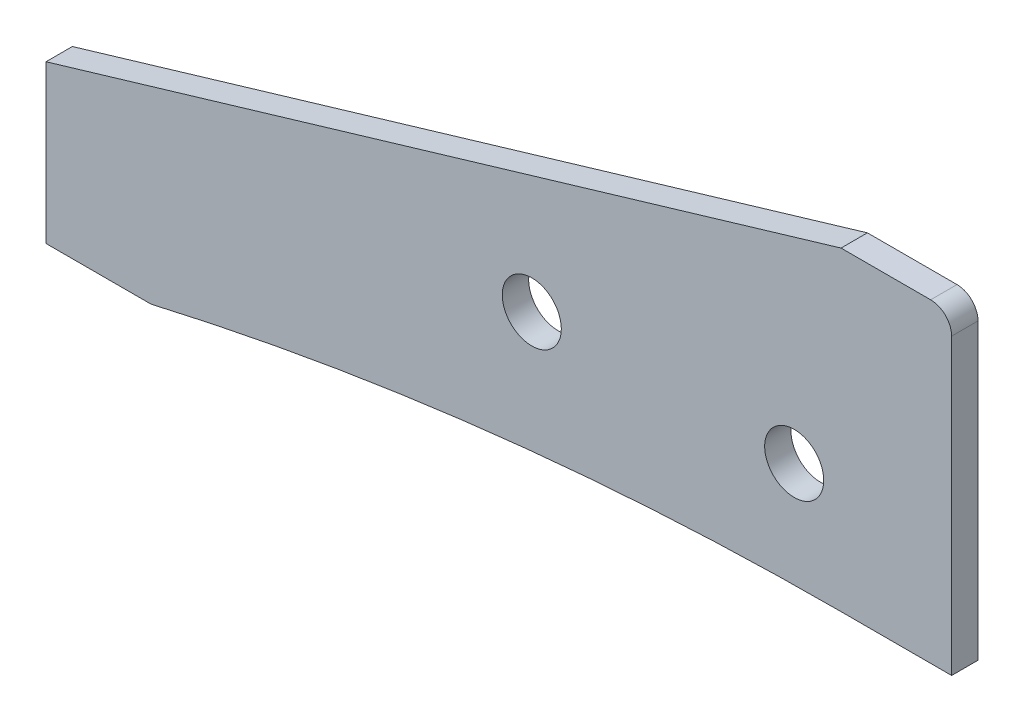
SolidWorks part; units mm, degrees
ref_plane "Front Plane" through (0, 0, 0) normal (0, 0, 1) x (1, 0, 0)
ref_plane "Top Plane" through (0, 0, 0) normal (0, 1, 0) x (1, 0, 0)
ref_plane "Right Plane" through (0, 0, 0) normal (1, 0, 0) x (0, 0, -1)
sketch "Sketch1" plane through (0, 0, 0) normal (0, 0, 1) x (1, 0, 0)
  line L0 (-2.54, 0) -> (-13.3821, 0)
  line L1 (-13.3821, 0) -> (-109.5805, -28.575)
  line L2 (-109.5805, -28.575) -> (-109.5805, -47.625)
  line L3 (-109.5805, -47.625) -> (-96.8805, -47.625)
  line L4 (0, -2.54) -> (0, -38.1)
  line L5 (0, -38.1) -> (-13.3821, -38.1)
  line L9 (-123.825, -47.625) -> (307.975, -47.625) construction
  arc A0 (-96.8805, -47.625) -> (-13.3821, -38.1) centre (-13.3821, -408.846) cw
  arc A1 (-2.54, 0) -> (0, -2.54) centre (-2.54, -2.54) cw
  point P11 (0, 0)
  dimension "D1" = 2.54
  dimension "D2" = 12.7
extrude "Boss-Extrude1" add sketch "Sketch1" against normal blind 3.1902
hole_wizard "9/32 (0.28125) Diameter Hole1" positions "Sketch2" profile "Sketch3" hole size "9/32" standard "ANSI Inch"
sketch "Sketch2" plane through (0, 0, 0) normal (0, 0, 1) x (1, 0, 0)
  line L0 (0, -38.1) -> (0, -2.54) construction
  line L1 (-13.3821, -38.1) -> (0, -38.1) construction
  point P0 (-19.05, -25.4)
  point P2 (-50.8, -25.4)
  dimension "D1" = 31.75
  dimension "D2" = 19.05
  dimension "D3" = 12.7
sketch "Sketch3" plane through (-19.05, -25.4, 0) normal (1, 0, 0) x (0, -1, 0)
  line L0 (0, 0) -> (0, 3.1902)
  line L1 (0, 3.1902) -> (3.5719, 3.1902)
  line L2 (3.5719, 3.1902) -> (3.5719, 0)
  line L5 (3.5719, 0) -> (0, 0)
  line L11 (0, -6.35) -> (0, 107.95) construction
  dimension "Thru Hole Dia." = 7.1437
  dimension "Thru Hole Depth" = 3.1902
